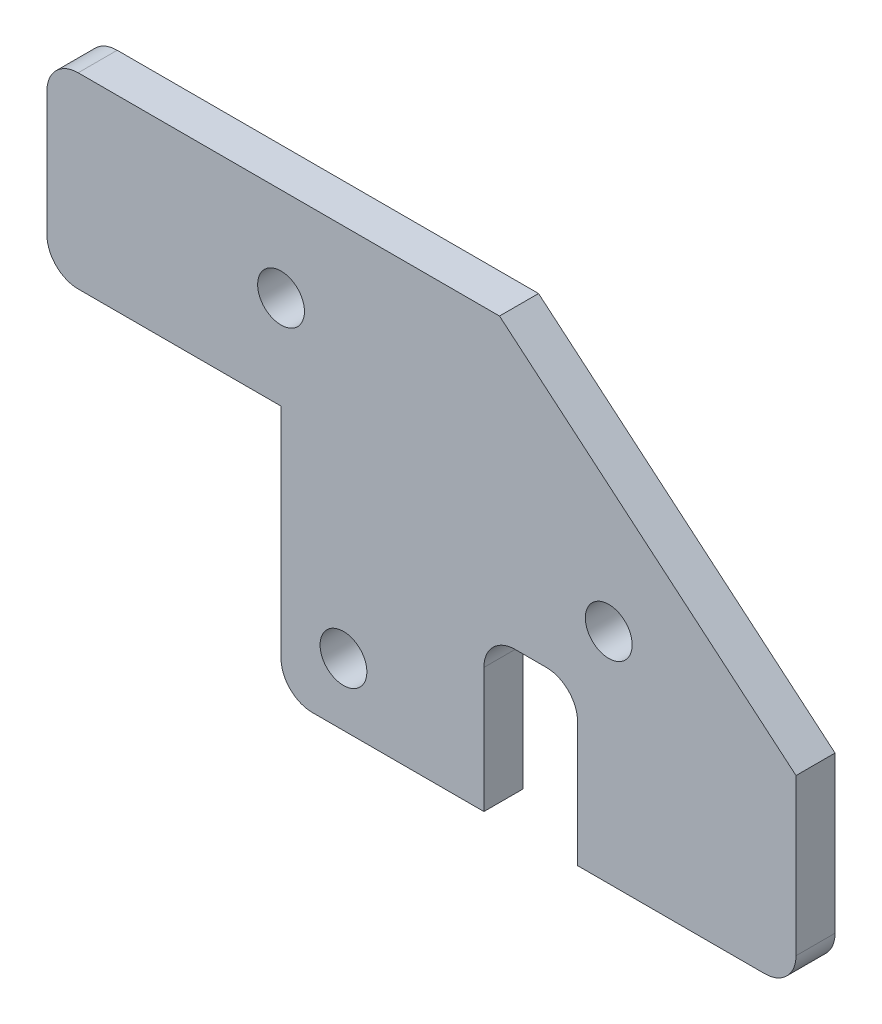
SolidWorks part; units mm, degrees
ref_plane "Plan de face" through (0, 0, 0) normal (0, 0, 1) x (1, 0, 0)
ref_plane "Plan de dessus" through (0, 0, 0) normal (0, 1, 0) x (1, 0, 0)
ref_plane "Plan de droite" through (0, 0, 0) normal (1, 0, 0) x (0, 0, -1)
sketch "Esquisse1" plane through (0, 0, 0) normal (0, 0, 1) x (1, 0, 0)
  line L0 (-21.3431, 0) -> (30.4342, 0) construction
  line L1 (0, 11.6417) -> (0, -46.0123) construction
  line L2 (-15, 6) -> (14, 6)
  line L3 (14, 6) -> (33, -10)
  line L4 (33, -10) -> (33, -22)
  line L5 (33, -22) -> (19, -22)
  line L6 (19, -22) -> (19, -12)
  line L7 (19, -12) -> (13, -12)
  line L8 (13, -12) -> (13, -22)
  line L9 (13, -22) -> (0, -22)
  line L10 (0, -22) -> (0, -6)
  line L11 (0, -6) -> (-15, -6)
  line L12 (-15, -6) -> (-15, 6)
  circle A0 centre (0, 0) radius 1.5
  circle A1 centre (4, -18) radius 1.5
  circle A2 centre (21, -8) radius 1.5
  dimension "D10" = 3
  dimension "D1" = 12
  dimension "D2" = 15
  dimension "D3" = 29
  dimension "D4" = 13
  dimension "D5" = 33
  dimension "D6" = 6
  dimension "D7" = 16
  dimension "D8" = 10
  dimension "D9" = 12
  dimension "D11" = 21
  dimension "D12" = 8
  dimension "D13" = 4
  dimension "D14" = 18
extrude "Base prismatique" add sketch "Esquisse1" along normal blind 2.5
fillet "Congés R2" radius 2 6 edges at (19, -12, 1.25) (13, -12, 1.25) (0, -22, 1.25) (33, -22, 1.25) (-15, -6, 1.25) (-15, 6, 1.25)
